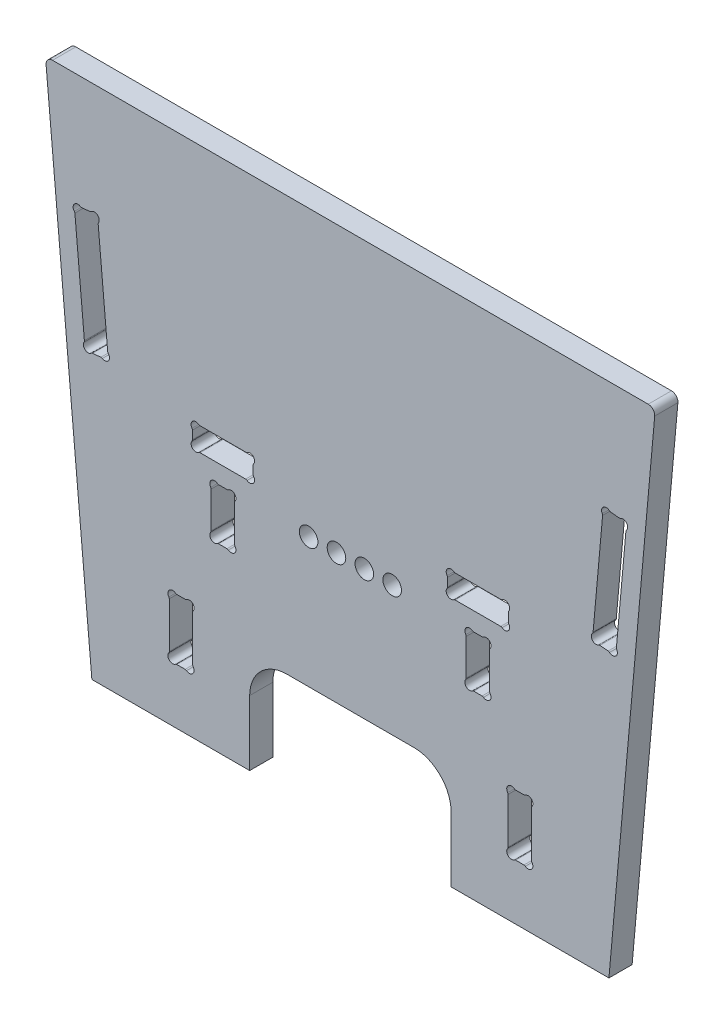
SolidWorks part; units mm, degrees
ref_plane "Front Plane" through (0, 0, 0) normal (0, 0, 1) x (1, 0, 0)
ref_plane "Top Plane" through (0, 0, 0) normal (0, 1, 0) x (1, 0, 0)
ref_plane "Right Plane" through (0, 0, 0) normal (1, 0, 0) x (0, 0, -1)
sketch "Sketch1" plane through (0, 0, 0) normal (0, 0, 1) x (1, 0, 0)
  line L0 (0, 0) -> (-50, 556.5)
  line L2 (170, 0) -> (0, 0)
  line L3 (-50, 556.5) -> (278.5, 556.5)
  line L4 (278.5, 556.5) -> (278.5, 110)
  line L6 (-50, 556.5) -> (1124, 556.5) construction
  line L9 (278.5, 110) -> (210, 110)
  line L10 (170, 70) -> (170, 0)
  line L12 (0, 0) -> (557, 0) construction
  line L14 (-50, 556.5) -> (-50, 0) construction
  arc A7 (210, 110) -> (170, 70) centre (210, 70) ccw
  point P3 (278.5, 0)
extrude "Boss-Extrude1" add sketch "Sketch1" along normal blind 25 contours L9 A7 L10 L2 L0 L3 L4
sketch "Sketch2" plane through (0, 0, 0) normal (0, 0, 1) x (1, 0, 0)
  line L0 (-0.6232, 370.1187) -> (-6.4667, 435.1567) construction
  line L1 (-8.0568, 312.0516) -> (-18.2886, 425.9308)
  line L2 (141.1, 282.4) -> (108.4, 282.4) construction
  line L3 (17.0421, 314.3066) -> (6.8103, 428.1858)
  line L4 (-2.0157, 435.5566) -> (-10.9178, 434.7568)
  line L5 (6.0827, 436.2842) -> (2.8137, 432.3698) construction
  line L6 (6.0827, 436.2842) -> (-4.7183, 556.5) construction
  line L7 (263.5, 249.9) -> (248.5, 249.9) construction
  line L8 (-17.3691, 556.5) -> (32.6309, 0) construction
  line L9 (-50, 556.5) -> (278.5, 556.5) construction
  line L10 (165.669, 269.8) -> (116.531, 269.8)
  line L11 (170, 0) -> (0, 0) construction
  line L12 (173.8, 286.869) -> (173.8, 277.931)
  line L13 (141.1, 295) -> (141.1, 269.8) construction
  line L14 (165.669, 295) -> (116.531, 295)
  line L15 (108.4, 286.869) -> (108.4, 277.931)
  line L16 (108.4, 295) -> (112.0062, 291.3938) construction
  line L17 (141.1, 222.4) -> (141.1, 250) construction
  line L18 (128.5, 202.931) -> (128.5, 241.869)
  line L19 (145.569, 194.8) -> (136.631, 194.8)
  line L22 (153.7, 222.4) -> (128.5, 222.4) construction
  line L24 (153.7, 202.931) -> (153.7, 241.869)
  line L25 (145.569, 250) -> (136.631, 250)
  line L27 (153.7, 250) -> (150.0938, 246.3938) construction
  line L28 (96, 92.4) -> (96, 125.1) construction
  line L29 (83.4, 67.831) -> (83.4, 116.969)
  line L30 (100.469, 59.7) -> (91.531, 59.7)
  line L31 (108.6, 92.4) -> (83.4, 92.4) construction
  line L32 (108.6, 67.831) -> (108.6, 116.969)
  line L33 (100.469, 125.1) -> (91.531, 125.1)
  line L34 (108.6, 125.1) -> (104.9938, 121.4938) construction
  line L35 (0, 0) -> (-50, 556.5) construction
  line L36 (-13.1727, 368.9912) -> (11.9262, 371.2462) construction
  line L37 (9.6713, 305.4806) -> (0.7692, 304.6808)
  line L38 (278.5, 556.5) -> (-50, 556.5) construction
  line L39 (-19.0072, 433.9296) -> (6.0917, 436.1846) construction
  line L40 (108.5, 295) -> (108.5, 269.8) construction
  line L41 (278.5, 110) -> (278.5, 556.5) construction
  line L42 (-18.9166, 434.0381) -> (-7.2296, 303.9621) construction
  line L43 (108.4, 269.9) -> (173.8, 269.9) construction
  line L44 (-50, 556.5) -> (0, 0) construction
  line L45 (108.5, 125.1) -> (108.5, 59.7) construction
  line L46 (170, -110) -> (278.5, -110) construction
  line L47 (170, 0) -> (170, 70) construction
  line L48 (0, 0) -> (170, 0) construction
  line L49 (170, -85) -> (278.5, -85) construction
  line L50 (128.5, 249.9) -> (153.7, 249.9) construction
  line L51 (224.25, 315) -> (224.25, -85) construction
  line L52 (128.5, 194.9) -> (153.7, 194.9) construction
  line L53 (263.5, 249.9) -> (278.5, 249.9) construction
  line L54 (248.5, 249.9) -> (233.5, 249.9) construction
  arc A0 (7.1665, 429.7122) -> (-0.5772, 436.1792) centre (2.8137, 432.3698) ccw
  arc A1 (7.1665, 429.7122) -> (6.8103, 428.1858) centre (9.3003, 428.4095) ccw
  arc A2 (-0.5772, 436.1792) -> (-2.0157, 435.5566) centre (-2.2394, 438.0466) cw
  arc A3 (-12.4442, 435.113) -> (-10.9178, 434.7568) centre (-11.1415, 437.2468) ccw
  arc A5 (-18.9111, 427.3692) -> (-12.4442, 435.113) centre (-15.1017, 430.7601) cw
  arc A7 (-18.9111, 427.3692) -> (-18.2886, 425.9308) centre (-20.7785, 425.707) cw
  arc A8 (17.6647, 312.8682) -> (17.0421, 314.3066) centre (19.5321, 314.5303) cw
  arc A9 (17.6647, 312.8682) -> (11.1977, 305.1244) centre (13.8552, 309.4773) cw
  arc A10 (11.1977, 305.1244) -> (9.6713, 305.4806) centre (9.895, 302.9906) ccw
  arc A11 (-0.6693, 304.0582) -> (0.7692, 304.6808) centre (0.9929, 302.1908) cw
  arc A12 (-8.413, 310.5251) -> (-0.6693, 304.0582) centre (-4.0601, 307.8676) ccw
  arc A13 (-8.413, 310.5251) -> (-8.0568, 312.0516) centre (-10.5468, 311.8278) ccw
  arc A14 (115.0426, 295.4914) -> (107.9086, 288.3574) centre (112.0062, 291.3938) ccw
  arc A15 (115.0426, 295.4914) -> (116.531, 295) centre (116.531, 297.5) ccw
  arc A16 (107.9086, 288.3574) -> (108.4, 286.869) centre (105.9, 286.869) cw
  arc A17 (107.9086, 276.4426) -> (108.4, 277.931) centre (105.9, 277.931) ccw
  arc A18 (115.0426, 269.3086) -> (107.9086, 276.4426) centre (112.0062, 273.4062) cw
  arc A19 (115.0426, 269.3086) -> (116.531, 269.8) centre (116.531, 267.3) cw
  arc A20 (167.1574, 269.3086) -> (165.669, 269.8) centre (165.669, 267.3) ccw
  arc A21 (167.1574, 269.3086) -> (174.2914, 276.4426) centre (170.1938, 273.4062) ccw
  arc A22 (174.2914, 276.4426) -> (173.8, 277.931) centre (176.3, 277.931) cw
  arc A23 (174.2914, 288.3574) -> (173.8, 286.869) centre (176.3, 286.869) ccw
  arc A24 (167.1574, 295.4914) -> (174.2914, 288.3574) centre (170.1938, 291.3938) cw
  arc A25 (167.1574, 295.4914) -> (165.669, 295) centre (165.669, 297.5) cw
  arc A26 (154.1914, 243.3574) -> (147.0574, 250.4914) centre (150.0938, 246.3938) ccw
  arc A27 (154.1914, 243.3574) -> (153.7, 241.869) centre (156.2, 241.869) ccw
  arc A28 (147.0574, 250.4914) -> (145.569, 250) centre (145.569, 252.5) cw
  arc A29 (135.1426, 250.4914) -> (136.631, 250) centre (136.631, 252.5) ccw
  arc A30 (128.0086, 243.3574) -> (135.1426, 250.4914) centre (132.1062, 246.3938) cw
  arc A31 (128.0086, 243.3574) -> (128.5, 241.869) centre (126, 241.869) cw
  arc A32 (128.0086, 201.4426) -> (128.5, 202.931) centre (126, 202.931) ccw
  arc A33 (128.0086, 201.4426) -> (135.1426, 194.3086) centre (132.1062, 198.4062) ccw
  arc A34 (135.1426, 194.3086) -> (136.631, 194.8) centre (136.631, 192.3) cw
  arc A35 (147.0574, 194.3086) -> (145.569, 194.8) centre (145.569, 192.3) ccw
  arc A36 (154.1914, 201.4426) -> (147.0574, 194.3086) centre (150.0938, 198.4062) cw
  arc A37 (154.1914, 201.4426) -> (153.7, 202.931) centre (156.2, 202.931) cw
  arc A38 (109.0914, 118.4574) -> (101.9574, 125.5914) centre (104.9938, 121.4938) ccw
  arc A39 (109.0914, 118.4574) -> (108.6, 116.969) centre (111.1, 116.969) ccw
  arc A40 (101.9574, 125.5914) -> (100.469, 125.1) centre (100.469, 127.6) cw
  arc A41 (90.0426, 125.5914) -> (91.531, 125.1) centre (91.531, 127.6) ccw
  arc A42 (82.9086, 118.4574) -> (90.0426, 125.5914) centre (87.0062, 121.4938) cw
  arc A43 (82.9086, 118.4574) -> (83.4, 116.969) centre (80.9, 116.969) cw
  arc A44 (82.9086, 66.3426) -> (83.4, 67.831) centre (80.9, 67.831) ccw
  arc A45 (82.9086, 66.3426) -> (90.0426, 59.2086) centre (87.0062, 63.3062) ccw
  arc A46 (90.0426, 59.2086) -> (91.531, 59.7) centre (91.531, 57.2) cw
  arc A47 (101.9574, 59.2086) -> (100.469, 59.7) centre (100.469, 57.2) ccw
  arc A48 (109.0914, 66.3426) -> (101.9574, 59.2086) centre (104.9938, 63.3062) cw
  arc A49 (109.0914, 66.3426) -> (108.6, 67.831) centre (111.1, 67.831) cw
  circle A50 centre (233.5, 249.9) radius 10
  circle A51 centre (263.5, 249.9) radius 10
  point P15 (-6.4667, 435.1567)
  point P58 (108.4, 282.4)
  point P92 (141.1, 250)
  point P126 (96, 125.1)
extrude "Cut-Extrude1" cut sketch "Sketch2" along normal through all
fillet "Fillet1" radius 7 1 edges at (-50, 556.5, 12.5)
mirror "Symétrie1" about plane through (278.5, 556.5, 25) normal (-1, 0, 0)
ref_plane "Plane1" through (278.5, 0, 0) normal (1, 0, 0) x (0, 0, -1)
equation "\"tool_diameter\"=10"
equation "\"hole_clearance\"=0.1"
equation "\"material_thickness\"=25"
equation "\"clearance\"=0.1"
equation "\"outer_slot\"=0.5"
equation "\"fillet\"=7"
equation "\"D1@Boss-Extrude1\"=\"material_thickness\""
equation "\"string\"= 2 * \"tool_diameter\" / 2 * cos ( 45deg )"
equation "\"angle\"= IIF ( \"string\" < \"limit\" , 45 , ( 180 - 2 * arcsin ( \"ThicknessVStool_dia\" ) ) / 2 )"
equation "\"limit\"= \"material_thickness\" / 2 * 5 / 6"
equation "\"ThicknessVStool_dia\"= IIF ( \"limit\" / \"tool_diameter\" > 1 , 1 , \"limit\" / \"tool_diameter\" )"
equation "\"D10@Sketch2\"=\"tool_diameter\" / 2 + \"hole_clearance\""
equation "\"D9@Sketch2\" = \"material_thickness\" / 2 + \"clearance\""
equation "\"D11@Sketch2\" = \"material_thickness\" / 10"
equation "\"D5@Sketch2\"=\"angle\""
equation "\"D15@Sketch2\"=\"tool_diameter\" / 2 + \"hole_clearance\""
equation "\"D14@Sketch2\" = \"material_thickness\" / 2 + \"clearance\""
equation "\"D16@Sketch2\" = \"material_thickness\" / 10"
equation "\"D12@Sketch2\"=\"angle\""
equation "\"D20@Sketch2\"=\"tool_diameter\" / 2 + \"hole_clearance\""
equation "\"D19@Sketch2\" = \"material_thickness\" / 2 + \"clearance\""
equation "\"D21@Sketch2\"=\"material_thickness\"/10"
equation "\"D17@Sketch2\"=\"angle\""
equation "\"D21@Sketch2\" = \"material_thickness\" / 10"
equation "\"D1@Fillet1\"=\"fillet\""
equation "\"D6@Sketch2\"=\"tool_diameter\" / 2 + \"hole_clearance\""
equation "\"D4@Sketch2\" = \"material_thickness\" / 2 + \"clearance\""
equation "\"D7@Sketch2\"=\"material_thickness\"/10"
equation "\"D7@Sketch2\" = \"material_thickness\" / 10"
equation "\"D24@Sketch2\"=40 + \"clearance\"*2 +\"material_thickness\""
equation "\"D25@Sketch2\"=\"clearance\""
equation "\"D27@Sketch2\"=\"clearance\""
equation "\"D8@Sketch2\"=(40 +\"material_thickness\" + \"clearance\"*2)/2"
equation "\"D29@Sketch2\"=\"clearance\""
equation "\"D18@Sketch2\"=40 + \"material_thickness\" +2 * \"clearance\"+\"clearance\"*2"
equation "\"D33@Sketch2\"=\"clearance\""
equation "\"D35@Sketch2\"=\"material_thickness\""
equation "\"D36@Sketch2\"=\"clearance\""
equation "\"D31@Sketch2\"=\"material_thickness\"+30"
equation "\"D38@Sketch2\"=\"clearance\""
equation "\"D3@Sketch1\"=(2440 - 8*13 - \"tool_diameter\"*11)/4"
equation "\"D4@Sketch1\"=(\"D2@Sketch1\"-50)/2 - \"tool_diameter\"/2"
equation "\"D2@Sketch1\"=(1220 - 2*13 - \"tool_diameter\"*2)"
equation "\"D3@Sketch2\"=\"angle\""
